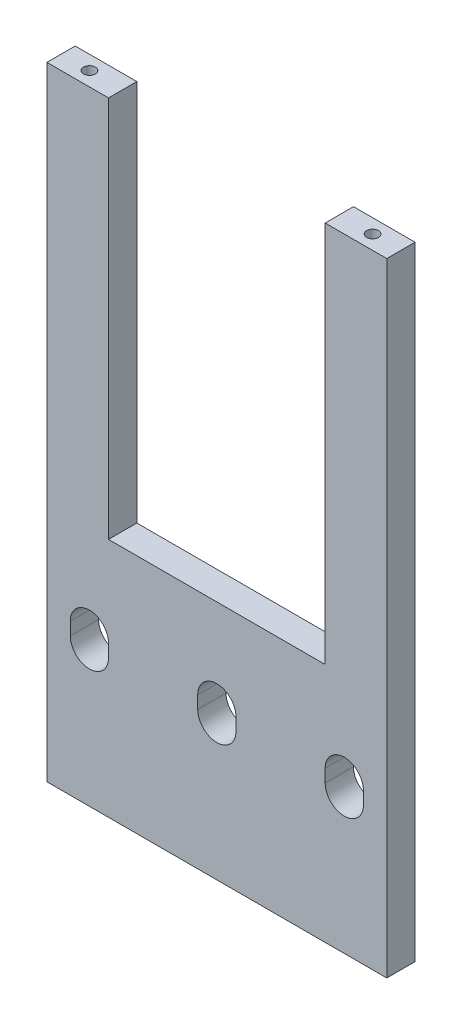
SolidWorks part; units mm, degrees
ref_plane "Спереди" through (0, 0, 0) normal (0, 0, 1) x (1, 0, 0)
ref_plane "Сверху" through (0, 0, 0) normal (0, 1, 0) x (1, 0, 0)
ref_plane "Справа" through (0, 0, 0) normal (1, 0, 0) x (0, 0, -1)
sketch "Эскиз1" plane through (0, 0, 0) normal (0, 0, 1) x (1, 0, 0)
  line L1 (60, 110) -> (-60, 110)
  line L2 (60, 110) -> (60, -110)
  line L3 (60, -110) -> (-60, -110)
  line L4 (-60, 110) -> (-60, -110)
  line L5 (60, 110) -> (-60, -110) construction
  line L6 (60, -110) -> (-60, 110) construction
  point P0 (0, 0)
  dimension "D1" = 120
  dimension "D2" = 220
extrude "Бобышка-Вытянуть1" add sketch "Эскиз1" along normal blind 10
hole_wizard "Прорезь с зазором M122" positions "Эскиз2" profile "Эскиз3" size "M12" standard "ISO"
sketch "Эскиз2" plane through (0, 0, 10) normal (0, 0, 1) x (1, 0, 0)
  line L0 (-45, -68) -> (-45, -50) construction
  line L1 (-60, -110) -> (60, -110) construction
  line L2 (-60, 110) -> (-60, -110) construction
  point P0 (-45, -59)
  point P4 (45, -59)
  point P12 (0, -59)
  dimension "D1" = 18
  dimension "D2" = 51
  dimension "D3" = 90
  dimension "D4" = 15
  dimension "D5" = 60
sketch "Эскиз3" plane through (-45, -59, 10) normal (1, 0, 0) x (0, -1, 0)
  line L0 (0, 0) -> (0, 10)
  line L1 (0, 10) -> (6.75, 10)
  line L2 (6.75, 10) -> (6.75, 0)
  line L5 (6.75, 0) -> (0, 0)
  line L11 (0, -6.35) -> (0, 107.95) construction
  dimension "Диаметр сквозного отверстия" = 13.5
  dimension "Глубина сквозного отверстия" = 10
sketch "Эскиз4" plane through (0, 0, 10) normal (0, 0, 1) x (1, 0, 0)
  line L0 (60, 110) -> (-60, 110) construction
  line L1 (-38.25, 110) -> (38.25, 110)
  line L2 (-38.25, 110) -> (-38.25, -25)
  line L3 (-38.25, -25) -> (38.25, -25)
  line L4 (38.25, 110) -> (38.25, -25)
  line L5 (-60, 110) -> (-60, -110) construction
  point P6 (0, -25)
  dimension "D1" = 76.5
  dimension "D2" = 60
  dimension "D3" = 135
extrude "Вырез-Вытянуть1" cut sketch "Эскиз4" against normal blind 10
hole_wizard "Отверстие обработанное метчиком M52" positions "Эскиз5" profile "Эскиз6" tap size "M5" standard "ISO"
sketch "Эскиз5" plane through (0, 110, 0) normal (0, 1, 0) x (1, 0, 0)
  line L0 (-60, -10) -> (-60, 0) construction
  line L2 (60, -10) -> (60, 0) construction
  line L3 (60, 0) -> (38.25, 0) construction
  line L4 (-60, -10) -> (-60, 0) construction
  line L5 (-60, 0) -> (60, 0) construction
  point P0 (-50, -5)
  point P2 (50, -5)
  point P14 (-50, -5)
  point P16 (50, -5)
  dimension "D1" = 10
  dimension "D2" = 10
  dimension "D3" = 5
  dimension "D4" = 10
  dimension "D5" = 5
sketch "Эскиз6" plane through (-50, 110, 5) normal (1, 0, 0) x (0, 0, 1)
  line L0 (0, 0) -> (0, 16.2618)
  line L1 (0, 16.2618) -> (2.1, 15)
  line L2 (2.1, 15) -> (2.1, 0)
  line L5 (2.1, 0) -> (0, 0)
  line L10 (0, 16.2618) -> (-2.1, 15) construction
  line L11 (0, -6.35) -> (0, 107.95) construction
  dimension "Диаметр сверла" = 4.2
  dimension "Глубина сверла" = 15
  dimension "Угол заточки сверла" = 118
hole_wizard "Отверстие обработанное метчиком M51" positions "Эскиз9" profile "Эскиз8" tap size "M5" standard "ISO"
sketch "Эскиз9" plane through (0, -110, 0) normal (0, -1, 0) x (-1, 0, 0)
  line L0 (60, -10) -> (60, 0) construction
  line L1 (-60, -10) -> (-60, 0) construction
  line L2 (60, -10) -> (-60, -10) construction
  line L3 (60, 0) -> (-60, 0) construction
  point P0 (50, -5)
  point P2 (-40, -5)
  point P12 (0, -5)
  dimension "D1" = 10
  dimension "D2" = 20
  dimension "D3" = 5
  dimension "D4" = 60
  dimension "D5" = 5
sketch "Эскиз8" plane through (-50, -110, 5) normal (1, 0, 0) x (0, 0, -1)
  line L0 (0, 0) -> (0, 16.2618)
  line L1 (0, 16.2618) -> (2.1, 15)
  line L2 (2.1, 15) -> (2.1, 0)
  line L5 (2.1, 0) -> (0, 0)
  line L10 (0, 16.2618) -> (-2.1, 15) construction
  line L11 (0, -6.35) -> (0, 107.95) construction
  dimension "Диаметр сверла" = 4.2
  dimension "Глубина сверла" = 15
  dimension "Угол заточки сверла" = 118
